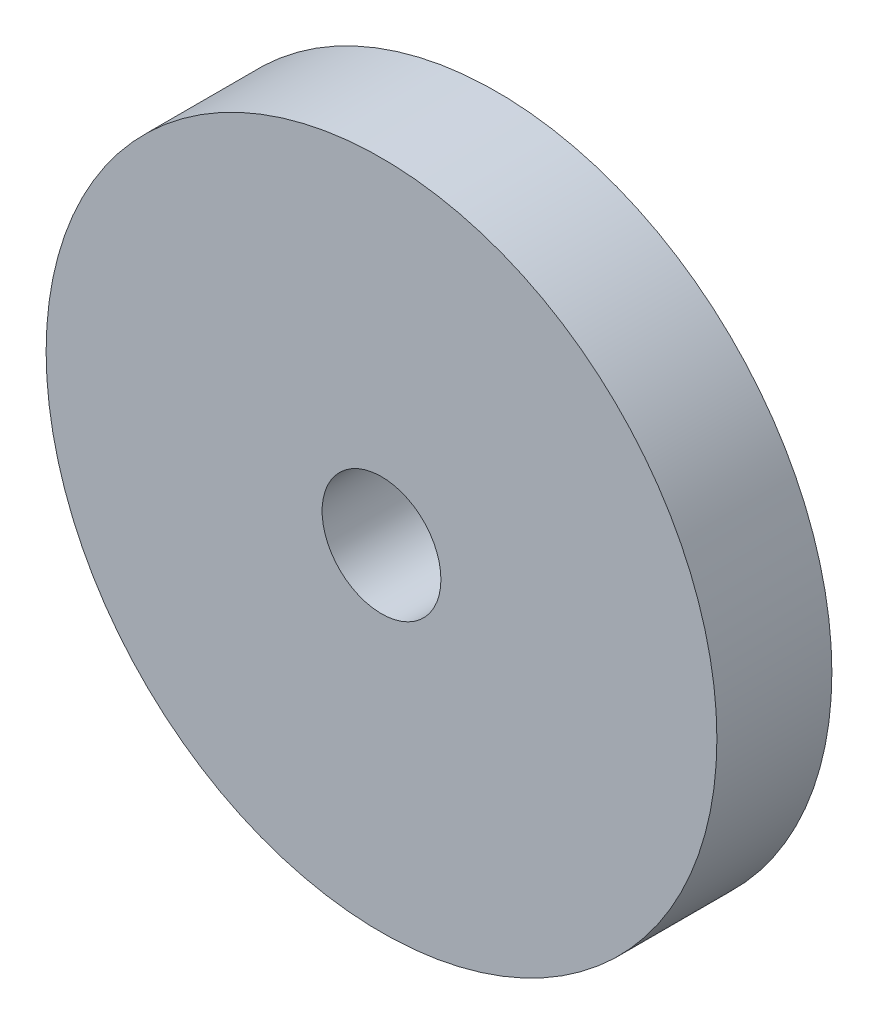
SolidWorks part; units mm, degrees
ref_plane "Plan de face" through (0, 0, 0) normal (0, 0, 1) x (1, 0, 0)
ref_plane "Plan de dessus" through (0, 0, 0) normal (0, 1, 0) x (1, 0, 0)
ref_plane "Plan de droite" through (0, 0, 0) normal (1, 0, 0) x (0, 0, -1)
sketch "Esquisse1" plane through (0, 0, 0) normal (0, 0, 1) x (1, 0, 0)
  circle A0 centre (0, 0) radius 3.1
  circle A1 centre (0, 0) radius 17.5
extrude "Extrusion1" add sketch "Esquisse1" along normal blind 6
